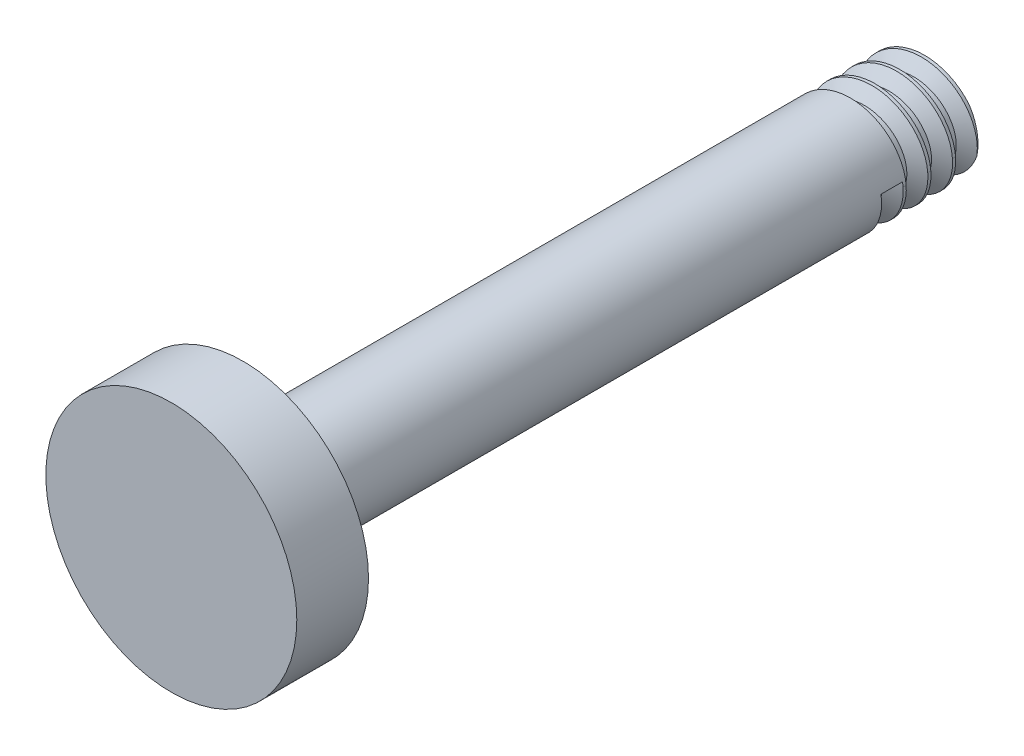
SolidWorks part; units mm, degrees
ref_plane "Front Plane" through (0, 0, 0) normal (0, 0, 1) x (1, 0, 0)
ref_plane "Top Plane" through (0, 0, 0) normal (0, 1, 0) x (1, 0, 0)
ref_plane "Right Plane" through (0, 0, 0) normal (1, 0, 0) x (0, 0, -1)
sketch "Sketch1" plane through (0, 0, 0) normal (0, 0, 1) x (1, 0, 0)
  circle A0 centre (0, 0) radius 3.81
  dimension "D1" = 7.62
extrude "Boss-Extrude1" add sketch "Sketch1" against normal mid plane 53.34
sketch "Sketch2" plane through (0, 0, 26.67) normal (0, 0, 1) x (1, 0, 0)
  circle A2 centre (0, 0) radius 8.89
  circle A3 centre (0, 0) radius 8.89
  dimension "D1" = 5.08
extrude "Boss-Extrude2" add sketch "Sketch2" against normal blind 5.08
thread "Thread1" pitch 1.75 start angle 0, offset 27.94, length 33.274, pitch 1.75, diameter 7.62
ref_plane "Plane1" through (3.81, 0, -54.61) normal (0, -1, 0) x (1, 0, 0)
sketch "Thread Profile1" plane through (3.81, 0, -54.61) normal (0, -1, 0) x (1, 0, 0)
  line L0 (0, 0) -> (0, 1.75) construction
  line L11 (0, 0) -> (0, 1.5312)
  line L12 (0, 1.5312) -> (-0.9472, 0.9844)
  line L13 (-0.9472, 0.9844) -> (-0.9472, 0.5469)
  line L15 (-0.9472, 0.5469) -> (0, 0)
  line L17 (-0.9472, 0.7656) -> (0, 0.7656) construction
  point P2 (0, 0)
  dimension "Pitch" = 1.75
  dimension "Profile_Angle" = 60
  dimension "Profile_Land" = 0.4375
  dimension "Profile_Height" = 0.9472
